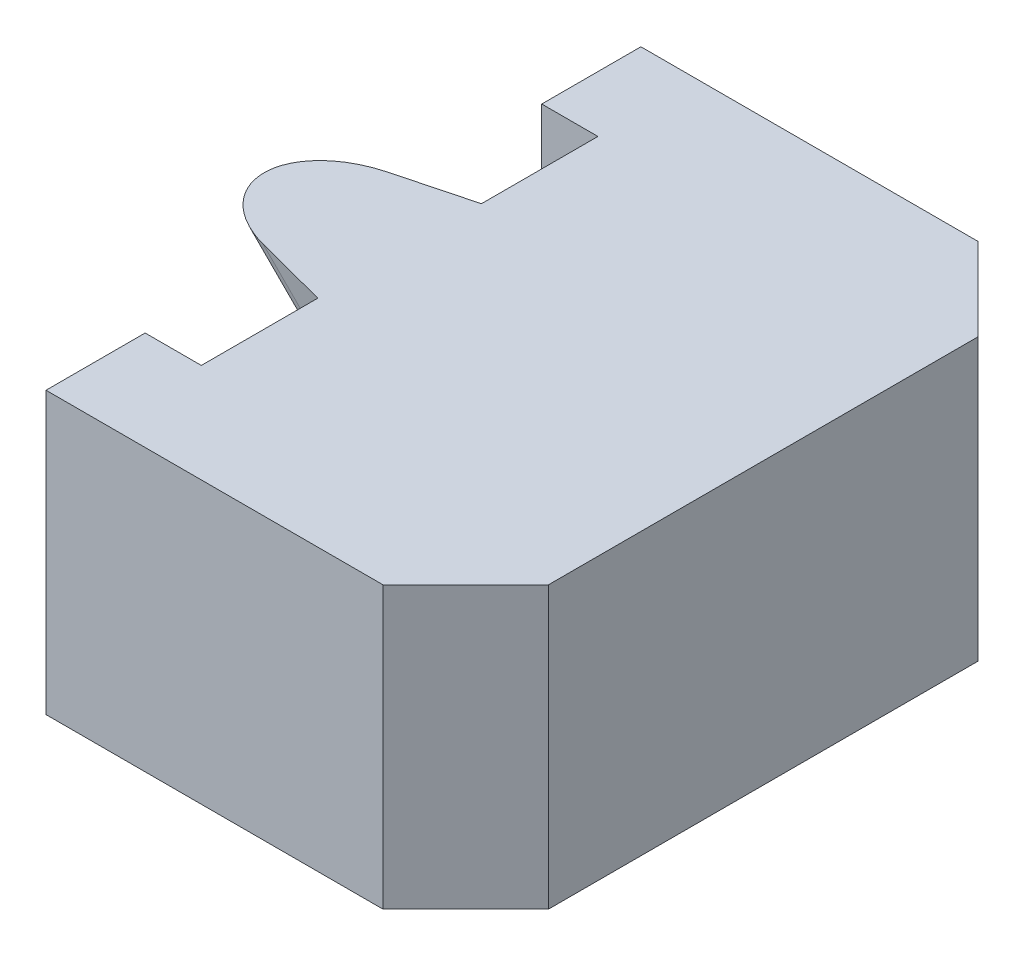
SolidWorks part; units mm, degrees
ref_plane "Vorne" through (0, 0, 0) normal (0, 0, 1) x (1, 0, 0)
ref_plane "Oben" through (0, 0, 0) normal (0, 1, 0) x (1, 0, 0)
ref_plane "Rechts" through (0, 0, 0) normal (1, 0, 0) x (0, 0, -1)
sketch "Skizze1" plane through (0, 0, 0) normal (0, 1, 0) x (1, 0, 0)
  line L1 (-44.6813, 23.83) -> (41.1068, 23.83)
  line L2 (-44.6813, 23.83) -> (-44.6813, -33.362)
  line L3 (-44.6813, -33.362) -> (41.1068, -33.362)
  line L4 (41.1068, 23.83) -> (41.1068, -33.362)
extrude "Linear austragen1" add sketch "Skizze1" along normal blind 12.5
sketch "Skizze2" plane through (0, 0, 0) normal (0, -1, 0) x (1, 0, 0)
  line L0 (-26.3604, 10.766) -> (-21.6604, 10.766)
  line L1 (-26.3604, 13.766) -> (-13.6604, 13.766)
  line L3 (-26.3604, -4.234) -> (-13.6604, -4.234)
  line L4 (-13.6604, 13.766) -> (-13.6604, -4.234)
  line L5 (-21.6604, 10.766) -> (-21.6604, -1.234)
  line L6 (-21.6604, -1.234) -> (-26.3604, -1.234)
  line L8 (-21.6604, 4.766) -> (-44.6813, 4.766) construction
  line L9 (-44.6813, -23.83) -> (-44.6813, 33.362) construction
  line L10 (-26.3604, -4.234) -> (-26.3604, -1.234)
  line L11 (-26.3604, 13.766) -> (-26.3604, 10.766)
  dimension "D1" = 18
  dimension "D2" = 3
  dimension "D3" = 3
  dimension "D6" = 8
extrude "Linear austragen2" add sketch "Skizze2" along normal blind 8.5
fillet "Verrundung1" radius 3 1 edges at (-21.6604, 0, 4.766)
ref_plane "Ebene1" through (0, 0, 4.766) normal (0, 0, -1) x (-1, 0, 0)
sketch "Skizze3" plane through (0, 0, 4.766) normal (0, 0, -1) x (-1, 0, 0)
  line L0 (19.6604, -6.5) -> (22.6604, -3.5)
  line L1 (26.3604, -8.5) -> (13.6604, -8.5) construction
  line L3 (13.6604, -8.5) -> (26.3604, -8.5) construction
  line L4 (13.6604, -8.5) -> (13.6604, 0) construction
  line L5 (26.3604, -8.5) -> (13.6604, -8.5) construction
  dimension "D1" = 45
  dimension "D2" = 2
  dimension "D3" = 9
  dimension "D4" = 5
ref_plane "Ebene2" through (-19.6604, -6.5, 4.766) normal (-0.7071, 0.7071, 0) x (0, 0, 1)
sketch "Skizze4" plane through (-19.6604, -6.5, 4.766) normal (-0.7071, 0.7071, 0) x (0, 0, 1)
  line L0 (0, -2.8284) -> (0, 4.5067) construction
  line L1 (-1.8839, -0.5291) -> (-3, 2.4716)
  line L2 (1.8839, -0.5291) -> (3, 2.4716)
  line L3 (-3, 2.4716) -> (3, 2.4716)
  line L5 (6, -2.8284) -> (-6, -2.8284) construction
  arc A0 (1.8839, -0.5291) -> (-1.8839, -0.5291) centre (0, 0.1716) cw
  point P8 (0, 2.4716)
  dimension "D4" = 2.01
  dimension "D1" = 6
  dimension "D2" = 5.3
  dimension "D3" = 3
extrude "Linear austragen3" add sketch "Skizze4" along normal blind 20
chamfer "Fase1" distance 2.5 angle 45 2 edges at (-13.6604, -4.25, -4.234) (-13.6604, -4.25, 13.766)
sketch "Skizze5" plane through (0, 0, -23.83) normal (0, 0, -1) x (-1, 0, 0)
  line L4 (-41.1068, 0) -> (44.6813, 0)
  line L5 (44.6813, 0) -> (44.6813, 12.5)
  line L6 (44.6813, 12.5) -> (-41.1068, 12.5)
  line L7 (-41.1068, 12.5) -> (-41.1068, 0)
  line L8 (-41.1068, 0) -> (44.6813, 0)
  line L9 (44.6813, 0) -> (44.6813, 12.5)
  line L10 (44.6813, 12.5) -> (-41.1068, 12.5)
  line L11 (-41.1068, 12.5) -> (-41.1068, 0)
  dimension "D1" = 0
extrude "Schnitt-Linear austragen1" cut sketch "Skizze5" against normal up to surface (57.1921 mm away)
sketch "Skizze6" plane through (0, 0, 0) normal (0, 1, 0) x (-1, 0, 0)
  line L12 (26.3604, -1.234) -> (24.6604, -1.234)
  line L13 (24.6604, -1.234) -> (24.6604, 2.2908)
  line L15 (24.6604, 2.2908) -> (26.9087, 2.8821)
  line L16 (24.6604, 2.2908) -> (26.9087, 2.8821)
  line L17 (24.6604, 10.766) -> (26.3604, 10.766)
  line L18 (26.9087, 6.6499) -> (24.6604, 7.2412)
  line L19 (26.3604, 13.766) -> (16.1604, 13.766)
  line L20 (13.6604, 11.266) -> (13.6604, -1.734)
  line L21 (16.1604, -4.234) -> (26.3604, -4.234)
  line L22 (26.3604, -4.234) -> (26.3604, -1.234)
  line L23 (26.3604, -1.234) -> (24.6604, -1.234)
  line L24 (24.6604, -1.234) -> (24.6604, 2.2908)
  line L25 (26.9087, 6.6499) -> (24.6604, 7.2412)
  line L26 (24.6604, 7.2412) -> (24.6604, 10.766)
  line L27 (24.6604, 7.2412) -> (24.6604, 10.766)
  line L28 (24.6604, 10.766) -> (26.3604, 10.766)
  line L29 (26.3604, -4.234) -> (26.3604, -1.234)
  line L30 (26.3604, 13.766) -> (16.1604, 13.766)
  line L31 (13.6604, 11.266) -> (13.6604, -1.734)
  line L32 (16.1604, -4.234) -> (26.3604, -4.234)
  line L33 (26.3604, 10.766) -> (26.3604, 13.766)
  line L34 (26.3604, 10.766) -> (26.3604, 13.766)
  line L35 (16.1604, 13.766) -> (13.6604, 11.266)
  line L36 (16.1604, 13.766) -> (13.6604, 11.266)
  line L37 (13.6604, -1.734) -> (16.1604, -4.234)
  line L38 (13.6604, -1.734) -> (16.1604, -4.234)
  ellipse E1 centre (25.9177, 4.766) end of major axis (23.0752, 4.766) minor radius 2.01 (26.9087, 2.8821) -> (26.9087, 6.6499) ccw
  ellipse E2 centre (25.9177, 4.766) end of major axis (23.0752, 4.766) minor radius 2.01 (26.9087, 2.8821) -> (26.9087, 6.6499) ccw
  dimension "D1" = 0
